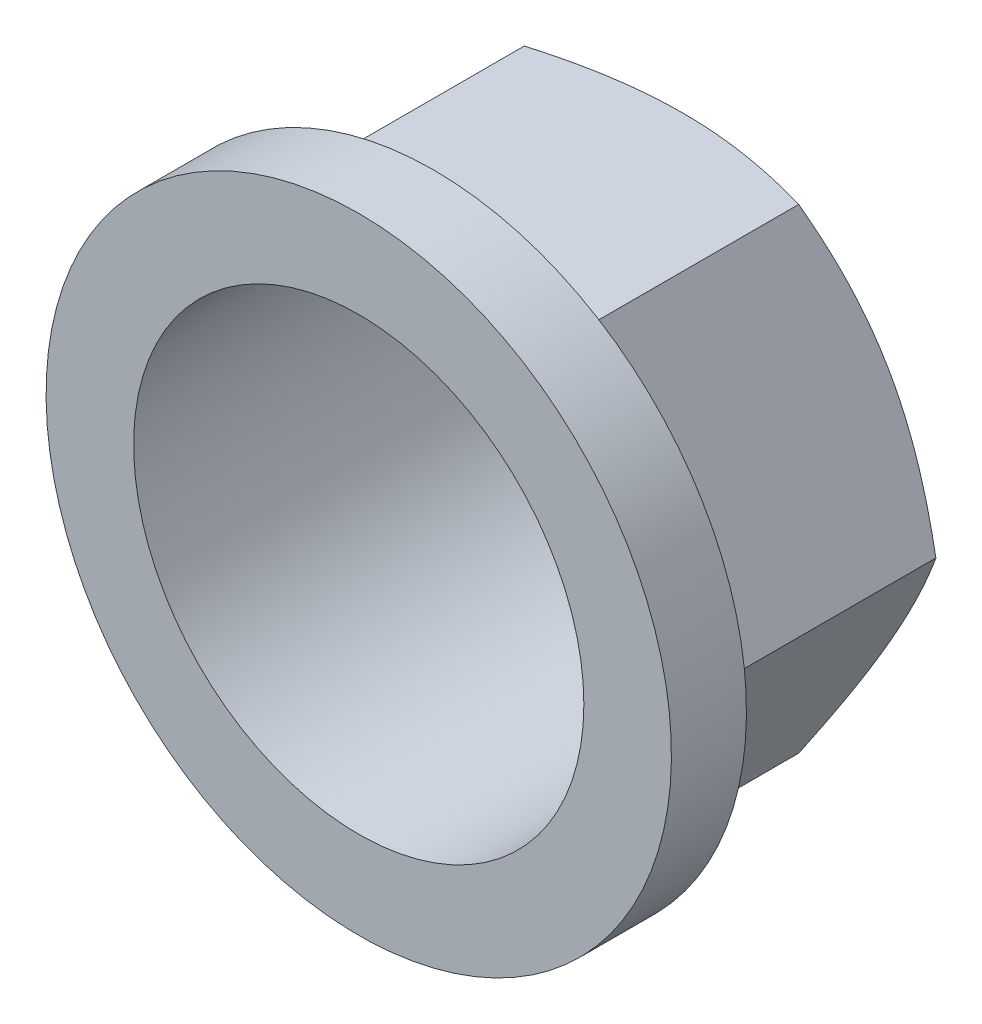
SolidWorks part; units mm, degrees
ref_plane "Plan1" through (0, 0, 0) normal (0, 0, 1) x (1, 0, 0)
ref_plane "Plan2" through (0, 0, 0) normal (0, 1, 0) x (1, 0, 0)
ref_plane "Plan3" through (0, 0, 0) normal (1, 0, 0) x (0, 0, -1)
sketch "Esquisse1" plane through (0, 0, 0) normal (0, 0, 1) x (1, 0, 0)
  line L3 (5.4848, -9.5) -> (10.9697, 0)
  line L4 (10.9697, 0) -> (5.4848, 9.5)
  line L5 (5.4848, 9.5) -> (-5.4848, 9.5)
  line L6 (-5.4848, 9.5) -> (-10.9697, 0)
  line L7 (-10.9697, 0) -> (-5.4848, -9.5)
  line L8 (-5.4848, -9.5) -> (5.4848, -9.5)
  circle A0 centre (0, 0) radius 10.9697 construction
  dimension "D3" = 19
extrude "Base-Extrusion" add sketch "Esquisse1" along normal mid plane 10.8
sketch "Esquisse5" plane through (0, 0, 0) normal (1, 0, 0) x (0, 0, -1)
  line L0 (5.4, -9.5) -> (-5.4, -28.2061)
  line L1 (0, 0) -> (-5.4, 0) construction
  line L2 (-5.4, -9.5) -> (-5.4, 0) construction
  line L3 (-5.4, -28.2061) -> (5.4, -28.2061)
  line L4 (5.4, -28.2061) -> (5.4, -9.5)
  line L5 (0, -18.8531) -> (5.4, -28.2061) construction
sketch "Esquisse4" plane through (0, 0, 5.4) normal (0, 0, 1) x (1, 0, 0)
  circle A0 centre (0, 0) radius 7.2
  dimension "D1" = 14.4
extrude "Enlèv. mat.-Extru.1" cut sketch "Esquisse4" against normal through all
revolve "Enlèvement de matière-Révolution1" cut sketch "Esquisse5" angle 360 about L1
mirror "Symétrie1" about plane through (0, 0, 0) normal (0, 0, 1) of "Enlèvement de matière-Révolution1"
sketch "Esquisse6" plane through (0, 0, 0) normal (1, 0, 0) x (0, 0, -1)
  line L0 (0, 0) -> (-31.0154, 0) construction
  line L1 (-4.5515, 0) -> (-7.5515, 0)
  line L2 (-4.5515, 0) -> (-4.5515, 12.5)
  line L3 (-4.5515, 12.5) -> (-7.5515, 12.5)
  line L4 (-7.5515, 0) -> (-7.5515, 12.5)
  dimension "D1" = 3
  dimension "D2" = 25
revolve "Révolution1" add sketch "Esquisse6" angle 360 about L0
sketch "Esquisse7" plane through (0, 0, 4.5515) normal (0, 0, -1) x (-1, 0, 0)
  circle A1 centre (0, 0) radius 7.2
  circle A2 centre (0, 0) radius 7.2
  dimension "D1" = 0
extrude "Enlèv. mat.-Extru.2" cut sketch "Esquisse7" against normal through all
sketch "Esquisse8" plane through (0, 0, 7.5515) normal (0, 0, 1) x (1, 0, 0)
  circle A0 centre (0, 0) radius 9
  dimension "D1" = 18
extrude "Enlèv. mat.-Extru.3" cut sketch "Esquisse8" against normal through all
equation "\"D1@Esquisse4\" = 0.8*\"D2@Représentation de filetage1\""
